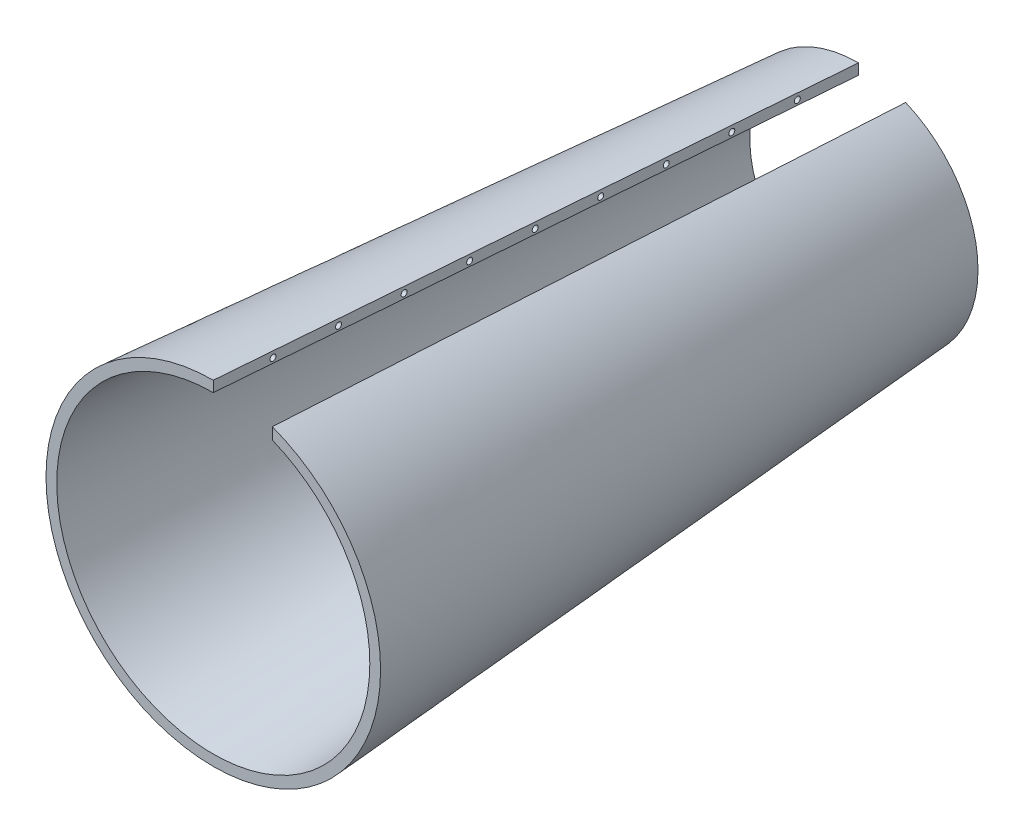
SolidWorks part; units mm, degrees
ref_plane "Front Plane" through (0, 0, 0) normal (0, 0, 1) x (1, 0, 0)
ref_plane "Top Plane" through (0, 0, 0) normal (0, 1, 0) x (1, 0, 0)
ref_plane "Right Plane" through (0, 0, 0) normal (1, 0, 0) x (0, 0, -1)
sketch "Sketch1" plane through (0, 0, 0) normal (0, 0, 1) x (1, 0, 0)
  line L0 (0, 50) -> (0, 45.5)
  line L1 (19.7294, 45.5) -> (19.7294, 41)
  arc A0 (0, 50) -> (50, 0) centre (0, 0) ccw
  arc A1 (0, 45.5) -> (45.5, 0) centre (0, 0) ccw
  arc A4 (45.5, 0) -> (19.7294, 41) centre (0, 0) ccw
  arc A5 (50, 0) -> (19.7294, 45.5) centre (0.669, 0) ccw
  dimension "D1" = 50
  dimension "D2" = 45.5
ref_plane "Plane1" through (0, 0, 270) normal (0, 0, 1) x (1, 0, 0)
sketch "Sketch2" plane through (0, 0, 270) normal (0, 0, 1) x (1, 0, 0)
  line L0 (0, 70) -> (0, 65.5)
  line L1 (24.6931, 60.6671) -> (24.6931, 65.5)
  arc A1 (0, 65.5) -> (65.5, 0) centre (0, 0) ccw
  arc A4 (65.5, 0) -> (24.6931, 60.6671) centre (0, 0) ccw
  arc A5 (0, 70) -> (70, 0) centre (0, 0) ccw
  arc A6 (70, 0) -> (24.6931, 65.5) centre (0, 0) ccw
  point P3 (0, 0)
  point P7 (0, 0)
  point P8 (0, 0)
  point P9 (0.0534, 65.5)
  point P10 (0, 0)
  dimension "D1" = 70
  dimension "D2" = 65.5
  dimension "D3" = 65.5
loft "Loft5" add profiles "Sketch1", "Sketch2"
sketch "Sketch5" plane through (0, 0, 0) normal (1, 0, 0) x (0, 0, -1)
  line L0 (-270, 65.5) -> (-270, 70) construction
  line L1 (0, 50) -> (-270, 70) construction
  circle A0 centre (-245, 65.6413) radius 1.25
  circle A1 centre (-217.5751, 63.6098) radius 1.25
  circle A2 centre (-190.1503, 61.5784) radius 1.25
  circle A3 centre (-162.7254, 59.5469) radius 1.25
  circle A4 centre (-135.3005, 57.5154) radius 1.25
  circle A5 centre (-107.8757, 55.4839) radius 1.25
  circle A6 centre (-80.4508, 53.4525) radius 1.25
  circle A7 centre (-53.026, 51.421) radius 1.25
  circle A8 centre (-25.6011, 49.3895) radius 1.25
  dimension "D1" = 2.5
  dimension "D2" = 25
  dimension "D3" = 2.5
  dimension "D4" = 9
sketch "Sketch6" plane through (19.7228, 0, -0.3626) normal (-0.9998, 0, 0.0184) x (0.0184, 0, 0.9998)
  line L0 (270.4083, 65.5) -> (270.4083, 60.6671) construction
  line L1 (0.3626, 45.5) -> (270.4083, 65.5) construction
  circle A0 centre (242.9083, 60.9565) radius 1.25
  circle A1 centre (215.4834, 58.9253) radius 1.25
  circle A2 centre (188.0585, 56.8942) radius 1.25
  circle A3 centre (160.6336, 54.8631) radius 1.25
  circle A4 centre (133.2087, 52.8319) radius 1.25
  circle A5 centre (105.7838, 50.8008) radius 1.25
  circle A6 centre (78.3589, 48.7697) radius 1.25
  circle A7 centre (50.934, 46.7385) radius 1.25
  circle A8 centre (23.5092, 44.7074) radius 1.25
  dimension "D1" = 2.5
  dimension "D2" = 27.5
  dimension "D3" = 2.5
  dimension "D4" = 9
extrude "Cut-Extrude3" cut sketch "Sketch6" against normal blind 2.5
extrude "Cut-Extrude4" cut sketch "Sketch5" against normal blind 2.5
